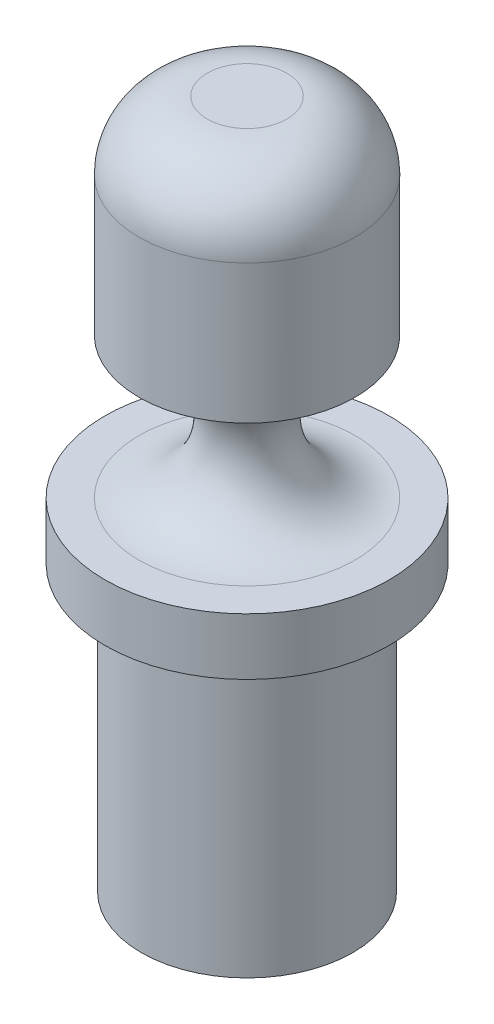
SolidWorks part; units mm, degrees
ref_plane "Front" through (0, 0, 0) normal (0, 0, 1) x (1, 0, 0)
ref_plane "Top" through (0, 0, 0) normal (0, 1, 0) x (1, 0, 0)
ref_plane "Right" through (0, 0, 0) normal (1, 0, 0) x (0, 0, -1)
sketch "Sketch1" plane through (0, 0, 0) normal (0, 0, 1) x (1, 0, 0)
  line L0 (0, 63.2807) -> (0, -67.1159) construction
  line L1 (0, 0) -> (2.3622, 0)
  line L2 (2.3622, 0) -> (2.3622, 6.35)
  line L3 (2.3622, 6.35) -> (3.175, 6.35)
  line L4 (3.175, 6.35) -> (3.175, 7.62)
  line L5 (3.175, 7.62) -> (2.413, 7.62)
  line L6 (2.413, 10.7696) -> (2.413, 15.3924)
  line L7 (2.413, 15.3924) -> (0, 15.3924)
  line L8 (0, 0) -> (0, 15.3924)
  arc A0 (2.413, 7.62) -> (2.413, 10.7696) centre (2.413, 9.1948) cw
  dimension "D6" = 1.5748
  dimension "D1" = 3.175
  dimension "D2" = 2.3622
  dimension "D3" = 1.27
  dimension "D4" = 2.413
  dimension "D5" = 4.6228
  dimension "D7" = 6.35
  dimension "D8" = 2.413
revolve "Revolve1" add sketch "Sketch1" angle 360 about L0
fillet "Fillet1" radius 1.524 1 edges at (0, 15.3924, 2.413)
